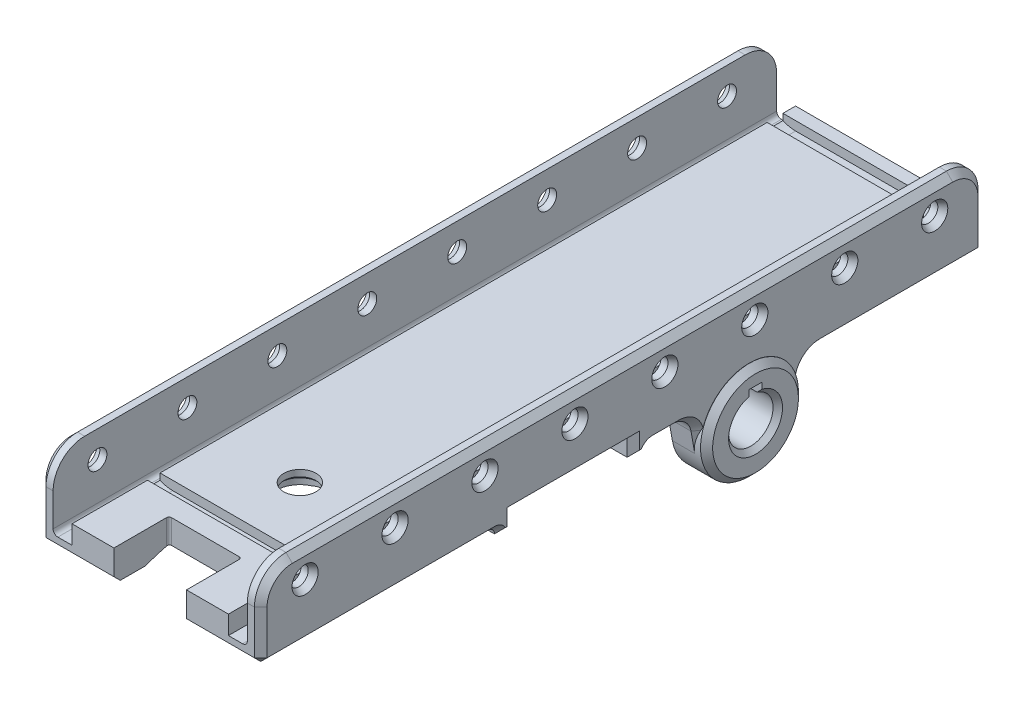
SolidWorks part; units mm, degrees
ref_plane "Спереди" through (0, 0, 0) normal (0, 0, 1) x (1, 0, 0)
ref_plane "Сверху" through (0, 0, 0) normal (0, 1, 0) x (1, 0, 0)
ref_plane "Справа" through (0, 0, 0) normal (1, 0, 0) x (0, 0, -1)
sketch "Эскиз1" plane through (0, 0, 0) normal (1, 0, 0) x (0, 0, -1)
  line L0 (-17.7476, 7.1374) -> (-24.3586, 7.1374)
  line L1 (51.1429, 27.7114) -> (-114.8461, 27.7114)
  line L2 (59.0804, 19.7739) -> (59.0804, 7.1374)
  line L3 (59.0804, 7.1374) -> (17.7476, 7.1374)
  line L4 (-122.7836, 19.7739) -> (-122.7836, 7.1374)
  line L5 (-62.4586, 5.5499) -> (-59.2836, 5.5499)
  line L6 (-59.2836, 5.5499) -> (-59.2836, 9.7171)
  line L7 (-59.2836, 9.7171) -> (-29.1211, 9.7171)
  line L8 (-29.1211, 9.7171) -> (-29.1211, 5.5499)
  line L9 (-29.1211, 5.5499) -> (-25.9461, 5.5499)
  line L10 (-64.0461, 7.1374) -> (-122.7836, 7.1374)
  line L11 (-157.9615, 10.3124) -> (115.9556, 10.3124) construction
  line L12 (-12.1162, -2.1364) -> (-13.0575, 3.2019)
  line L13 (12.1162, -2.1364) -> (13.0575, 3.2019)
  line L14 (0, -34.2287) -> (0, 64.7812) construction
  arc A0 (-12.1162, -2.1364) -> (12.1162, -2.1364) centre (0, 0) ccw
  arc A1 (-62.4586, 5.5499) -> (-64.0461, 7.1374) centre (-64.0461, 5.5499) ccw
  arc A2 (-25.9461, 5.5499) -> (-24.3586, 7.1374) centre (-24.3586, 5.5499) cw
  arc A3 (13.0575, 3.2019) -> (17.7476, 7.1374) centre (17.7476, 2.3749) cw
  arc A4 (-13.0575, 3.2019) -> (-17.7476, 7.1374) centre (-17.7476, 2.3749) ccw
  arc A5 (51.1429, 27.7114) -> (59.0804, 19.7739) centre (51.1429, 19.7739) cw
  arc A6 (-114.8461, 27.7114) -> (-122.7836, 19.7739) centre (-114.8461, 19.7739) ccw
  circle A7 centre (46.609, 21.0058) radius 2.3749
  circle A8 centre (24.003, 21.0058) radius 2.3749
  circle A9 centre (1.397, 21.0058) radius 2.3749
  circle A10 centre (-21.209, 21.0058) radius 2.3749
  circle A11 centre (-43.815, 21.0058) radius 2.3749
  circle A12 centre (-66.421, 21.0058) radius 2.3749
  circle A13 centre (-89.027, 21.0058) radius 2.3749
  circle A14 centre (-111.633, 21.0058) radius 2.3749
  dimension "D1" = 24.6062
  dimension "D7" = 1.5875
  dimension "D15" = 4.7625
  dimension "D17" = 7.9375
  dimension "D18" = 4.7498
  dimension "D2" = 181.864
  dimension "D3" = 20.574
  dimension "D4" = 3.175
  dimension "D5" = 3.175
  dimension "D6" = 30.1625
  dimension "D8" = 10.3124
  dimension "D9" = 3.175
  dimension "D10" = 1.1906
  dimension "D11" = 63.5
  dimension "D12" = 59.0804
  dimension "D13" = 10
  dimension "D14" = 10
  dimension "D16" = 4.7625
  dimension "D19" = 10.6934
  dimension "D20" = 12.4714
  dimension "D21" = 8
extrude "Бобышка-Вытянуть1" add sketch "Эскиз1" along normal mid plane 55.5625
sketch "Эскиз3" plane through (0, 0, 0) normal (1, 0, 0) x (0, 0, -1)
  circle A0 centre (0, 0) radius 12.3031
  arc A1 (-12.1162, -2.1364) -> (12.1162, -2.1364) centre (0, 0) ccw construction
extrude "Бобышка-Вытянуть2" add sketch "Эскиз3" along normal mid plane 58.7248
sketch "Эскиз4" plane through (0, 0, -59.0804) normal (0, 0, -1) x (-1, 0, 0)
  line L0 (0, -12.1281) -> (0, 63.2279) construction
  line L1 (-24.4094, 27.7114) -> (24.4094, 27.7114)
  line L2 (24.4094, 27.7114) -> (24.4094, 11.503)
  line L3 (23.2188, 10.3124) -> (19.6596, 10.3124)
  line L4 (19.6596, 10.3124) -> (19.6596, 14.986)
  line L5 (19.6596, 14.986) -> (-19.6596, 14.986)
  line L6 (-19.6596, 14.986) -> (-19.6596, 10.3124)
  line L7 (-19.6596, 10.3124) -> (-23.2188, 10.3124)
  line L8 (-24.4094, 11.503) -> (-24.4094, 27.7114)
  line L9 (-27.7812, 27.7114) -> (27.7812, 27.7114) construction
  line L10 (-27.7812, 23.3807) -> (-27.7812, 18.6309) construction
  arc A0 (24.4094, 11.503) -> (23.2188, 10.3124) centre (23.2188, 11.503) cw
  arc A1 (-23.2188, 10.3124) -> (-24.4094, 11.503) centre (-23.2188, 11.503) cw
  point P17 (-27.7812, 21.0058)
  dimension "D3" = 1.1906
  dimension "D1" = 4.7498
  dimension "D2" = 48.8188
  dimension "D4" = 4.6736
  dimension "D5" = 10.6934
extrude "Вырез-Вытянуть1" cut sketch "Эскиз4" against normal through all
ref_plane "Плоскость1" through (0, 0, -55.9054) normal (0, 0, 1) x (1, 0, 0)
sketch "Эскиз6" plane through (0, 0, -55.9054) normal (0, 0, 1) x (1, 0, 0)
  line L0 (0, 0) -> (0, 29.2275) construction
  line L1 (22.0196, 14.986) -> (-22.0196, 14.986)
  line L2 (16.4719, 12.7254) -> (-16.4719, 12.7254)
  line L3 (19.6596, 14.986) -> (-19.6596, 14.986) construction
  line L6 (24.4094, 19.7739) -> (24.4094, 11.503) construction
  arc A0 (16.4719, 12.7254) -> (22.0196, 14.986) centre (16.4719, 20.6629) ccw
  arc A1 (-16.4719, 12.7254) -> (-22.0196, 14.986) centre (-16.4719, 20.6629) cw
  dimension "D1" = 7.9375
  dimension "D2" = 2.2606
extrude "Вырез-Вытянуть2" cut sketch "Эскиз6" along normal blind 3.9624
ref_plane "Плоскость2" through (0, 0, 100.6602) normal (0, 0, 1) x (1, 0, 0)
sketch "Эскиз7" plane through (0, 0, 100.6602) normal (0, 0, 1) x (1, 0, 0)
  line L0 (22.0196, 14.986) -> (-22.0196, 14.986)
  line L1 (16.4719, 12.7254) -> (-16.4719, 12.7254)
  line L2 (19.6596, 14.986) -> (-19.6596, 14.986) construction
  line L3 (-16.4719, 12.7254) -> (16.4719, 12.7254) construction
  arc A0 (16.4719, 12.7254) -> (22.0196, 14.986) centre (16.4719, 20.6629) ccw
  arc A1 (-16.4719, 12.7254) -> (-22.0196, 14.986) centre (-16.4719, 20.6629) cw
  arc A2 (-19.6596, 13.3936) -> (-16.4719, 12.7254) centre (-16.4719, 20.6629) ccw construction
  arc A4 (16.4719, 12.7254) -> (19.6596, 13.3936) centre (16.4719, 20.6629) ccw construction
extrude "Вырез-Вытянуть3" cut sketch "Эскиз7" along normal blind 3.1496
sketch "Эскиз5" plane through (0, 14.986, 0) normal (0, 1, 0) x (1, 0, 0)
  line L0 (19.6596, -122.7836) -> (-19.6596, -122.7836) construction
  line L1 (9.1186, -122.7836) -> (-9.1186, -122.7836)
  line L2 (9.1186, -122.7836) -> (9.1186, -109.5756)
  line L3 (8.4836, -108.9406) -> (-8.4836, -108.9406)
  line L4 (-9.1186, -122.7836) -> (-9.1186, -109.5756)
  line L5 (0, 0) -> (0, -136.6874) construction
  line L6 (19.6596, 55.9054) -> (-19.6596, 55.9054) construction
  line L7 (19.6596, -100.6602) -> (-19.6596, -100.6602) construction
  circle A0 centre (0, -85.1662) radius 4.0386
  arc A1 (-8.4836, -108.9406) -> (-9.1186, -109.5756) centre (-8.4836, -109.5756) ccw
  arc A2 (9.1186, -109.5756) -> (8.4836, -108.9406) centre (8.4836, -109.5756) ccw
  dimension "D1" = 8.0772
  dimension "D5" = 0.635
  dimension "D2" = 18.2372
  dimension "D3" = 164.846
  dimension "D4" = 15.494
extrude "Вырез-Вытянуть4" cut sketch "Эскиз5" against normal through all
sketch "Эскиз8" plane through (0, 7.1374, 0) normal (0, -1, 0) x (1, 0, 0)
  circle A0 centre (0, 85.1662) radius 5.9563
  circle A1 centre (0, 85.1662) radius 4.0386 construction
  dimension "D1" = 11.9126
extrude "Вырез-Вытянуть5" cut sketch "Эскиз8" against normal offset from surface (5.461 mm away) 2.3876
chamfer "Фаска1" distance 0.7937 angle 45 1 edges at (0, 12.5984, 81.1276)
sketch "Эскиз9" plane through (-29.3624, 0, 0) normal (-1, 0, 0) x (0, 0, 1)
  line L0 (0, 8.128) -> (0, -5.588) construction
  line L1 (-1.5875, 5.3578) -> (-1.5875, 8.128)
  line L2 (-1.5875, 8.128) -> (1.5875, 8.128)
  line L3 (1.5875, 8.128) -> (1.5875, 5.3578)
  arc A0 (-1.5875, 5.3578) -> (1.5875, 5.3578) centre (0, 0) ccw
  dimension "D1" = 11.176
  dimension "D2" = 3.175
  dimension "D3" = 13.716
extrude "Вырез-Вытянуть6" cut sketch "Эскиз9" against normal through all
sketch "Эскиз10" plane through (0, 0, 0) normal (1, 0, 0) x (0, 0, -1)
  line L0 (11.1125, 11.4808) -> (-4.7625, 11.4808)
  line L5 (-47.7831, -12.3031) -> (54.1331, -12.3031)
  arc A0 (11.1125, 11.4808) -> (54.1331, -12.3031) centre (11.1125, -39.3192) cw
  arc A1 (-4.7625, 11.4808) -> (-47.7831, -12.3031) centre (-4.7625, -39.3192) ccw
  circle A2 centre (0, 0) radius 12.3031 construction
  dimension "D1" = 50.8
  dimension "D2" = 50.8
  dimension "D3" = 4.7625
  dimension "D4" = 11.1125
  dimension "D5" = 11.4808
extrude "Вырез-Вытянуть7" cut sketch "Эскиз10" against normal mid plane 38.1
sketch "Эскиз12" plane through (0, 0, 0) normal (1, 0, 0) x (0, 0, -1)
  line L0 (-114.8461, 7.1374) -> (-64.0461, 7.1374)
  line L1 (-97.1684, 10.3124) -> (-79.7908, 10.3124)
  line L2 (-122.7836, 19.7739) -> (-122.7836, 7.1374) construction
  line L3 (-21.0531, 7.1374) -> (-21.0531, 5.5499)
  line L4 (-21.0531, 5.5499) -> (-64.0461, 5.5499)
  line L5 (-64.0461, 7.1374) -> (-64.0461, 5.5499)
  line L6 (-61.1187, 13.8684) -> (30.6356, 13.8684)
  line L7 (-122.7836, 7.1374) -> (-64.0461, 7.1374) construction
  line L8 (-62.4586, 5.5499) -> (-59.2836, 5.5499) construction
  line L9 (-21.0531, 7.1374) -> (55.9054, 7.1374)
  line L10 (-24.3586, 7.1374) -> (-17.7476, 7.1374) construction
  arc A0 (-114.8461, 7.1374) -> (-97.1684, 10.3124) centre (-97.1684, -40.4876) cw
  arc A1 (-79.7908, 10.3124) -> (-61.1187, 13.8684) centre (-61.1187, -36.9316) cw
  arc A2 (55.9054, 7.1374) -> (30.6356, 13.8684) centre (30.6356, -36.9316) ccw
  dimension "D1" = 50.8
  dimension "D2" = 50.8
  dimension "D3" = 50.8
  dimension "D4" = 7.9375
  dimension "D5" = 3.175
  dimension "D6" = 61.1187
  dimension "D7" = 13.8684
  dimension "D8" = 3.175
extrude "Вырез-Вытянуть9" cut sketch "Эскиз12" against normal mid plane 31.75
chamfer "Фаска2" distance 1.5875 angle 30 16 edges at (-27.7812, 21.0058, 109.2581) (-27.7812, 21.0058, 86.6521) (-27.7812, 21.0058, 64.0461) (-27.7812, 21.0058, 41.4401) (-27.7812, 21.0058, 18.8341) (-27.7812, 21.0058, -3.7719) (-27.7812, 21.0058, -26.3779) (-27.7812, 21.0058, -48.9839) (27.7812, 21.0058, -26.3779) (27.7812, 21.0058, -48.9839) (27.7812, 21.0058, -3.7719) (27.7812, 21.0058, 18.8341) (27.7812, 21.0058, 41.4401) (27.7812, 21.0058, 64.0461) (27.7812, 21.0058, 86.6521) (27.7812, 21.0058, 109.2581)
chamfer "Фаска3" distance 1.524 angle 45 18 edges at (19.05, 6.6724, 25.4811) (19.05, 7.1374, -24.7066) (19.05, 7.1374, 21.0531) (19.05, 6.0232, -14.6864) (19.05, 6.0232, 14.6864) (19.05, 0.5327, -12.5869) (19.05, 0.5327, 12.5869) (19.05, -12.3031, 0) (29.3624, 0, -12.3031) (-19.05, 6.6724, 25.4811) (-19.05, 7.1374, -24.7066) (-19.05, 7.1374, 21.0531) (-19.05, 6.0232, -14.6864) (-19.05, 6.0232, 14.6864) (-19.05, 0.5327, -12.5869) (-19.05, 0.5327, 12.5869) (-19.05, -12.3031, 0) (-29.3624, 0, -12.3031)
chamfer "Фаска4" distance 1.1906 angle 45 2 edges at (29.3624, -5.588, 0) (-29.3624, -5.588, 0)
fillet "Скругление1" radius 0.7937 10 edges at (-15.875, 9.5123, 106.1487) (-15.875, 12.1568, -43.711) (-15.875, 12.9715, 70.6226) (15.875, 9.5123, 106.1487) (15.875, 12.1568, -43.711) (15.875, 12.9715, 70.6226) (-15.875, 10.3124, 88.4796) (-15.875, 13.8684, 15.2416) (15.875, 10.3124, 88.4796) (15.875, 13.8684, 15.2416)
chamfer "Фаска5" distance 1.5875 angle 45 40 edges at (-27.7812, 0.5327, -12.5869) (-27.7812, 6.0232, -14.6864) (-27.7812, 7.1374, -38.414) (27.7812, 0.5327, -12.5869) (27.7812, 6.0232, -14.6864) (27.7812, 7.1374, -38.414) (27.7812, 0.5327, 12.5869) (27.7812, 6.6724, 25.4811) (27.7812, 6.0232, 14.6864) (27.7812, 7.1374, 21.0531) (27.7812, 5.5499, 27.5336) (27.7812, 7.6335, 29.1211) (27.7812, 9.7171, 44.2023) (27.7812, 5.5499, 60.8711) (-27.7812, 0.5327, 12.5869) (-27.7812, 6.6724, 25.4811) (-27.7812, 6.0232, 14.6864) (-27.7812, 7.1374, 21.0531) (-27.7812, 5.5499, 27.5336) (-27.7812, 7.6335, 29.1211) (-27.7812, 9.7171, 44.2023) (-27.7812, 7.6335, 59.2836) (-27.7812, 5.5499, 60.8711) (-27.7812, 13.4556, -59.0804) (-27.7812, 25.3866, -56.7556) (-27.7812, 27.7114, 31.8516) (-27.7812, 6.6724, 62.9236) (-27.7812, 25.3866, 120.4588) (-27.7812, 7.1374, 93.4148) (-27.7812, 13.4556, 122.7836) (-18.4499, 7.1374, 122.7836) (27.7812, 13.4556, -59.0804) (27.7812, 25.3866, -56.7556) (27.7812, 27.7114, 31.8516) (27.7812, 6.6724, 62.9236) (27.7812, 25.3866, 120.4588) (27.7812, 7.1374, 93.4148) (18.4499, 7.1374, 122.7836) (27.7812, 13.4556, 122.7836) (0, 7.1374, -59.0804)
